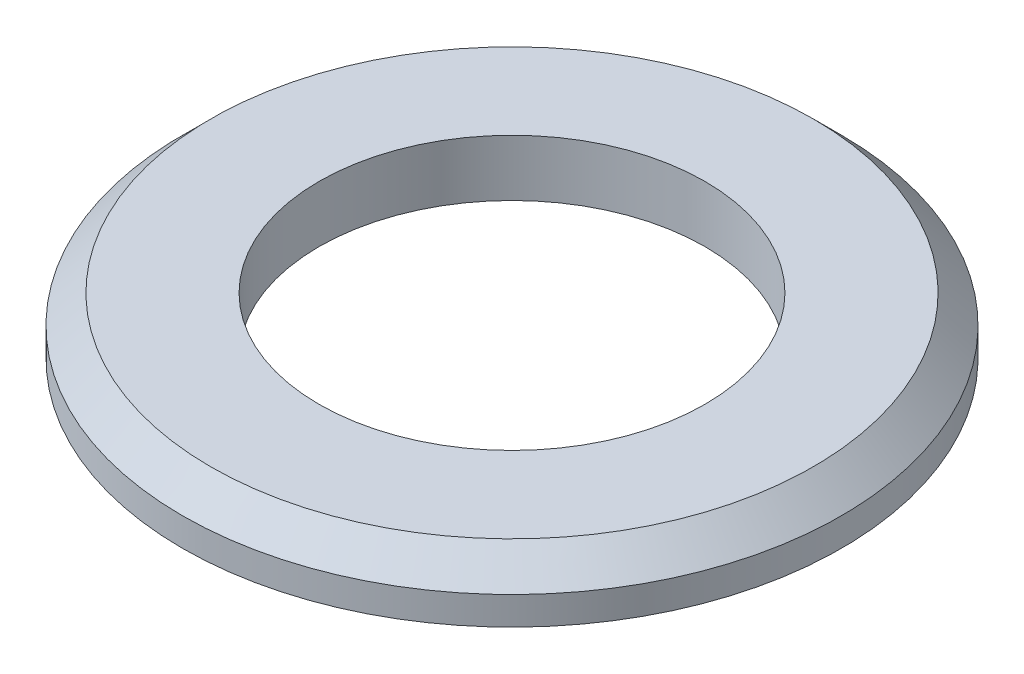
SolidWorks part; units mm, degrees
ref_plane "Front" through (0, 0, 0) normal (0, 0, 1) x (1, 0, 0)
ref_plane "Top" through (0, 0, 0) normal (0, 1, 0) x (1, 0, 0)
ref_plane "Right" through (0, 0, 0) normal (1, 0, 0) x (0, 0, -1)
sketch "Sketch1" plane through (0, 0, 0) normal (0, 1, 0) x (1, 0, 0)
  circle A0 centre (0, 0) radius 41
  circle A1 centre (0, 0) radius 70
extrude "Extrude1" add sketch "Sketch1" along normal blind 12
chamfer "Chamfer1" distance 6 1 edges at (0, 12, 70)
